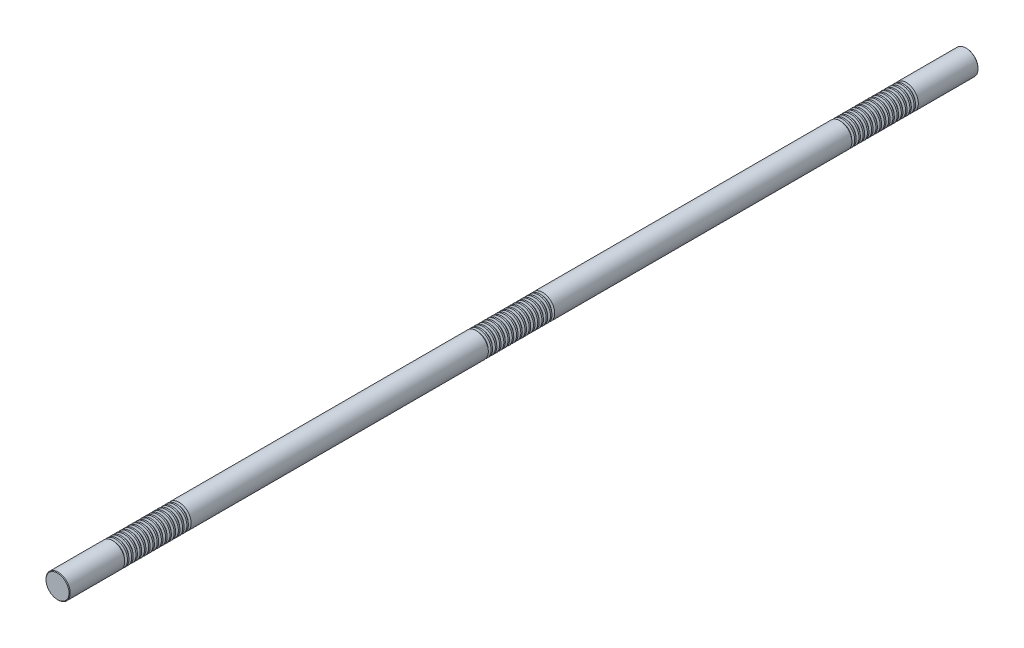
SolidWorks part; units mm, degrees
ref_plane "Front Plane" through (0, 0, 0) normal (0, 0, 1) x (1, 0, 0)
ref_plane "Top Plane" through (0, 0, 0) normal (0, 1, 0) x (1, 0, 0)
ref_plane "Right Plane" through (0, 0, 0) normal (1, 0, 0) x (0, 0, -1)
sketch "Sketch1" plane through (0, 0, 0) normal (0, 0, 1) x (1, 0, 0)
  circle A0 centre (0, 0) radius 20
  dimension "D1" = 40
extrude "Boss-Extrude1" add sketch "Sketch1" along normal mid plane 1500
chamfer "Chamfer1" distance 1 angle 45 2 edges at (20, 0, -750) (20, 0, 750)
sketch "Sketch2" plane through (0, 0, 0) normal (1, 0, 0) x (0, 0, -1)
  line L0 (650.5359, 20) -> (645.9641, 20)
  line L1 (749, 20) -> (-749, 20) construction
  line L2 (645.9641, 20) -> (647.0359, 16)
  line L3 (647.0359, 16) -> (649.4641, 16)
  line L4 (649.4641, 16) -> (650.5359, 20)
  line L5 (750, -19) -> (750, 19) construction
  point P4 (648.25, 20)
  point P7 (648.25, 16)
  point P8 (650, 18)
  point P9 (646.5, 18)
  dimension "D1" = 3.5
  dimension "D2" = 100
  dimension "D3" = 4
  dimension "D4" = 30
revolve "Cut-Revolve1" cut sketch "Sketch2" angle 360 about axis through (0, 0, 750) along (0, 0, -1)
pattern_linear "LPattern1" count 16 spacing 7 along (0, 0, 1) of "Cut-Revolve1"
pattern_linear "LPattern2" count 3 spacing 600 along (0, 0, 1) of "Cut-Revolve1", "LPattern1"
